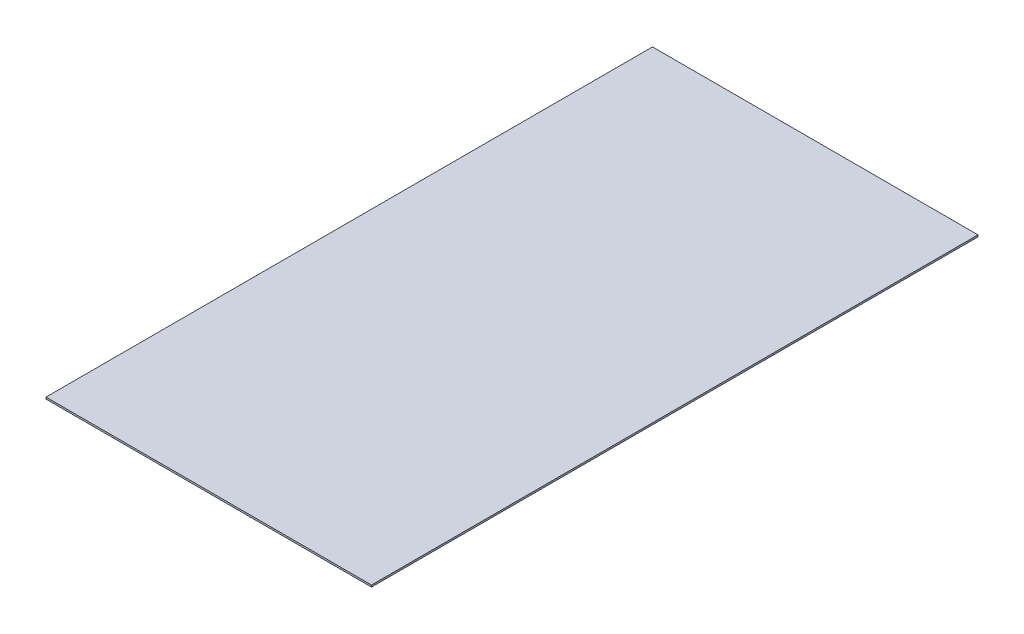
SolidWorks part; units mm, degrees
ref_plane "FRONT" through (0, 0, 0) normal (0, 0, 1) x (1, 0, 0)
ref_plane "TOP" through (0, 0, 0) normal (0, 1, 0) x (1, 0, 0)
ref_plane "RIGHT" through (0, 0, 0) normal (1, 0, 0) x (0, 0, -1)
sketch "Sketch1" plane through (0, 0, 0) normal (0, 1, 0) x (1, 0, 0)
  line L1 (-429.4188, 800.1) -> (429.4187, 800.1)
  line L2 (-429.4188, 800.1) -> (-429.4187, -800.1)
  line L3 (-429.4187, -800.1) -> (429.4188, -800.1)
  line L4 (429.4187, 800.1) -> (429.4188, -800.1)
  line L5 (-429.4188, 800.1) -> (429.4188, -800.1) construction
  line L6 (-429.4187, -800.1) -> (429.4187, 800.1) construction
  point P0 (0, 0)
  dimension "D1" = 858.8375
  dimension "D2" = 1600.2
extrude "Boss-Extrude1" add sketch "Sketch1" along normal blind 4.7625
